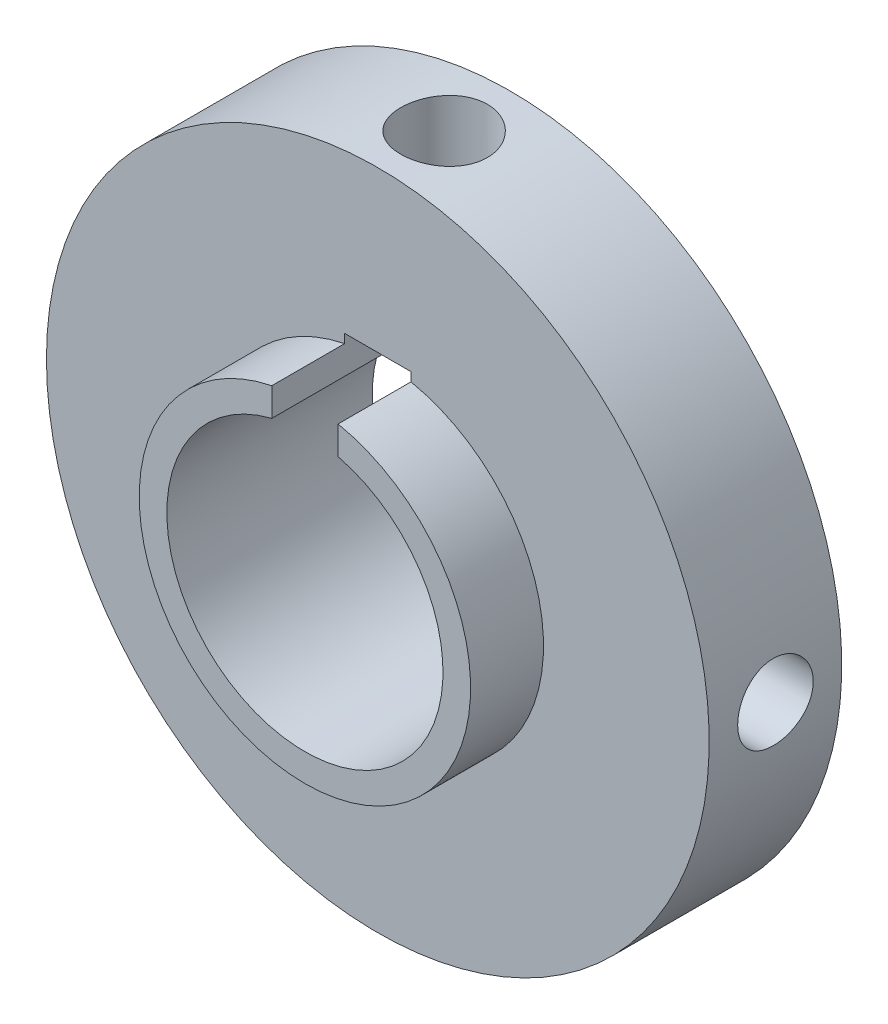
SolidWorks part; units mm, degrees
ref_plane "Front Plane" through (0, 0, 0) normal (0, 0, 1) x (1, 0, 0)
ref_plane "Top Plane" through (0, 0, 0) normal (0, 1, 0) x (1, 0, 0)
ref_plane "Right Plane" through (0, 0, 0) normal (1, 0, 0) x (0, 0, -1)
sketch "Sketch1" plane through (0, 0, 0) normal (0, 1, 0) x (1, 0, 0)
  line L0 (0, 72.8201) -> (0, 0) construction
  line L1 (0, 0) -> (-77.7246, 0) construction
  line L2 (7.9375, 11.811) -> (7.9375, 0)
  line L3 (7.9375, 0) -> (9.525, 0)
  line L4 (9.525, 0) -> (9.525, 4.191)
  line L5 (9.525, 4.191) -> (19.05, 4.191)
  line L6 (19.05, 4.191) -> (19.05, 11.811)
  line L7 (19.05, 11.811) -> (7.9375, 11.811)
  dimension "D1" = 7.62
  dimension "D2" = 11.811
  dimension "D3" = 38.1
  dimension "D4" = 15.875
  dimension "D5" = 19.05
revolve "Revolve1" add sketch "Sketch1" angle 360 about L0
sketch "Sketch2" plane through (0, 0, -11.811) normal (0, 0, -1) x (-1, 0, 0)
  line L0 (1.905, 9.8425) -> (1.905, 7.7055)
  line L1 (-1.905, 9.8425) -> (1.905, 9.8425)
  line L2 (-1.905, 7.7055) -> (-1.905, 9.8425)
  line L3 (0, 0) -> (0, 9.8425) construction
  circle A0 centre (0, 0) radius 7.9375 construction
  arc A1 (-1.905, 7.7055) -> (1.905, 7.7055) centre (0, 0) ccw
  dimension "D1" = 9.8425
  dimension "D2" = 3.81
extrude "Extrude1" cut sketch "Sketch2" against normal up to surface (11.811 mm away)
sketch "Sketch3" plane through (0, 0, 0) normal (0, 1, 0) x (1, 0, 0)
  circle A0 centre (0, 8.001) radius 2.4892
  dimension "D1" = 4.9784
  dimension "D2" = 8.001
extrude "Extrude2" cut sketch "Sketch3" along normal up to next
sketch "Sketch4" plane through (0, 0, 0) normal (1, 0, 0) x (0, 0, -1)
  circle A0 centre (8.001, 0) radius 2.1717
  dimension "D1" = 4.3434
  dimension "D2" = 8.001
extrude "Extrude3" cut sketch "Sketch4" along normal up to next
